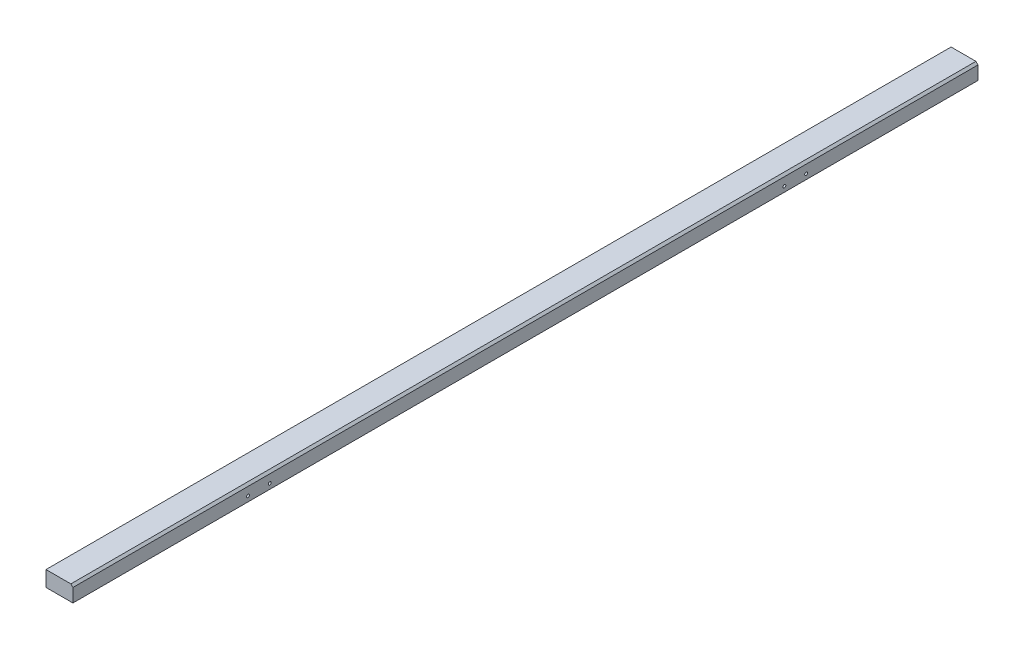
SolidWorks part; units mm, degrees
ref_plane "Face" through (0, 0, 0) normal (0, 0, 1) x (1, 0, 0)
ref_plane "Dessus" through (0, 0, 0) normal (0, 1, 0) x (1, 0, 0)
ref_plane "Droite" through (0, 0, 0) normal (1, 0, 0) x (0, 0, -1)
sketch "Esquisse1" plane through (0, 0, 0) normal (0, 0, 1) x (1, 0, 0)
  line L0 (48, 30) -> (52, 26)
  line L1 (0, 0) -> (52, 0)
  line L2 (0, 0) -> (0, 30)
  line L3 (0, 30) -> (48, 30)
  line L4 (52, 0) -> (52, 26)
  point P1 (52, 30)
  dimension "D1" = 52
  dimension "D2" = 30
  dimension "D5" = 4
extrude "Extrusion1" add sketch "Esquisse1" along normal blind 1748
hole_wizard "Dégagement M51" positions "Esquisse3" profile "Esquisse2" hole size "M5" standard "ISO"
sketch "Esquisse3" plane through (52, 0, 0) normal (1, 0, 0) x (0, 0, -1)
  line L0 (-1748, 0) -> (-1748, 26) construction
  line L1 (-1748, 0) -> (0, 0) construction
  point P0 (-1410, 10)
  point P1 (-1368, 10)
  point P3 (-374, 10)
  point P5 (-332, 10)
  dimension "D1" = 42
  dimension "D2" = 42
  dimension "D3" = 380
  dimension "D4" = 994
  dimension "D5" = 10
  dimension "D6" = 10
  dimension "D7" = 10
  dimension "D8" = 10
sketch "Esquisse2" plane through (52, 10, 1410) normal (0, 1, 0) x (0, 0, -1)
  line L0 (0, 0) -> (0, 52)
  line L1 (0, 52) -> (2.75, 52)
  line L2 (2.75, 52) -> (2.75, 0)
  line L5 (2.75, 0) -> (0, 0)
  line L11 (0, -6.35) -> (0, 107.95) construction
  dimension "Diamètre du perçage jusqu'au prochain" = 5.5
  dimension "Profondeur du perçage jusqu'au prochain" = 52
